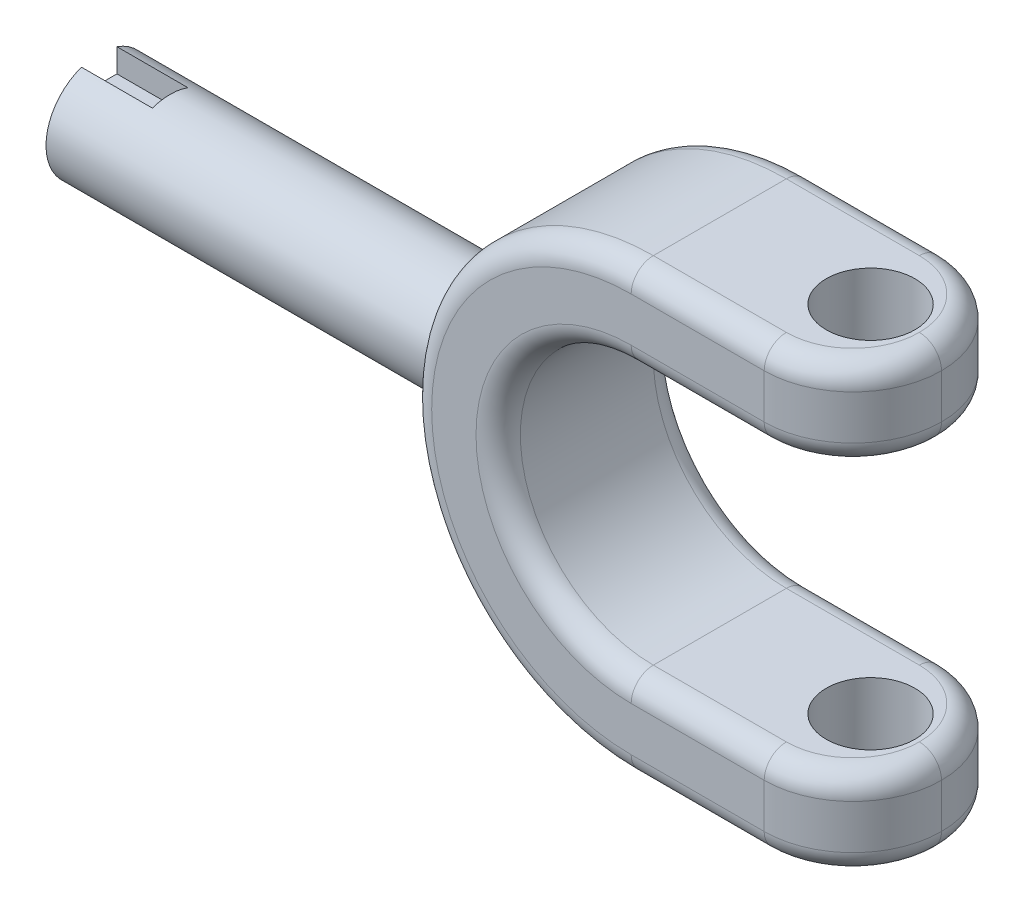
SolidWorks part; units mm, degrees
ref_plane "Plan 1" through (0, 0, 0) normal (0, 0, 1) x (1, 0, 0)
ref_plane "Plan 2" through (0, 0, 0) normal (0, 1, 0) x (1, 0, 0)
ref_plane "Plan 3" through (0, 0, 0) normal (1, 0, 0) x (0, 0, -1)
sketch "Esquisse1" plane through (0, 0, 0) normal (0, 0, 1) x (1, 0, 0)
  line L0 (25, 25) -> (0, 25)
  line L1 (25, 15) -> (0, 15)
  line L2 (0, 0) -> (99, 0) construction
  line L3 (25, -15) -> (0, -15)
  line L4 (25, -25) -> (0, -25)
  line L5 (25, 25) -> (25, 15)
  line L6 (25, -15) -> (25, -25)
  arc A0 (0, 15) -> (0, -15) centre (0, 0) ccw
  arc A1 (0, 25) -> (0, -25) centre (0, 0) ccw
  dimension "D1" = 30
  dimension "D2" = 50
  dimension "D3" = 25
extrude "Base-Extrusion" add sketch "Esquisse1" along normal blind 20
sketch "Esquisse2" plane through (0, 25, 0) normal (0, 1, 0) x (-1, 0, 0)
  line L0 (-25, 10) -> (-9, 10) construction
  line L1 (-25, 20) -> (-25, 0) construction
  circle A0 centre (-17, 10) radius 5
  dimension "D1" = 10
  dimension "D2" = 8
extrude "Enlèv. mat.-Extru.1" cut sketch "Esquisse2" against normal through all
ref_plane "Plan1" through (-70, 0, 0) normal (1, 0, 0) x (0, 0, -1)
sketch "Esquisse3" plane through (-70, 0, 0) normal (1, 0, 0) x (0, 0, -1)
  line L0 (-20, 0) -> (0, 0) construction
  line L1 (-10, 0) -> (-20, 0) construction
  line L2 (-10, 0) -> (0, 0) construction
  line L3 (-20, 25) -> (-20, -25) construction
  circle A0 centre (-10, 0) radius 6
  dimension "D1" = 12
extrude "Boss.-Extru.1" add sketch "Esquisse3" along normal up to surface (45 mm away)
fillet "Congé1" radius 10 8 edges at (25, 20, 20) (25, -15, 10) (25, -25, 10) (25, 25, 10) (25, 15, 10) (25, -20, 20) (25, -20, 0) (25, 20, 0)
fillet "Congé2" radius 2.5 20 edges at (-25, 0, 20) (7.5, -25, 20) (7.5, 25, 20) (7.5, -15, 20) (7.5, 25, 0) (22.0711, 25, 2.9289) (22.0711, 25, 17.0711) (22.0711, 15, 2.9289) (22.0711, 15, 17.0711) (7.5, -15, 0) (-15, 0, 20) (22.0711, -15, 2.9289) (22.0711, -15, 17.0711) (22.0711, -25, 2.9289) (22.0711, -25, 17.0711) (7.5, 15, 20) (7.5, -25, 0) (-25, 0, 0) (7.5, 15, 0) (-15, 0, 0)
sketch "Esquisse4" plane through (-70, 0, 0) normal (-1, 0, 0) x (0, 0, 1)
  line L0 (10, 8.6018) -> (10, -15) construction
  line L1 (10, -25) -> (10, -15) construction
  line L4 (8, 5.6569) -> (8, 3)
  line L5 (8, 3) -> (12, 3)
  line L6 (12, 5.6569) -> (12, 3)
  circle A0 centre (10, 0) radius 6 construction
  arc A1 (12, 5.6569) -> (8, 5.6569) centre (10, 0) ccw
  dimension "D1" = 4
  dimension "D2" = 3
extrude "Enlèv. mat.-Extru.2" cut sketch "Esquisse4" against normal blind 8
sketch "Esq_WRNL_Compact001" plane through (0, 0, 0) normal (0, 0, 1) x (1, 0, 0)
  line L0 (-71, -26) -> (-71, 26)
  line L1 (26, -26) -> (26, 26)
  line L2 (-71, -26) -> (26, -26)
  line L3 (-71, 26) -> (26, 26)
